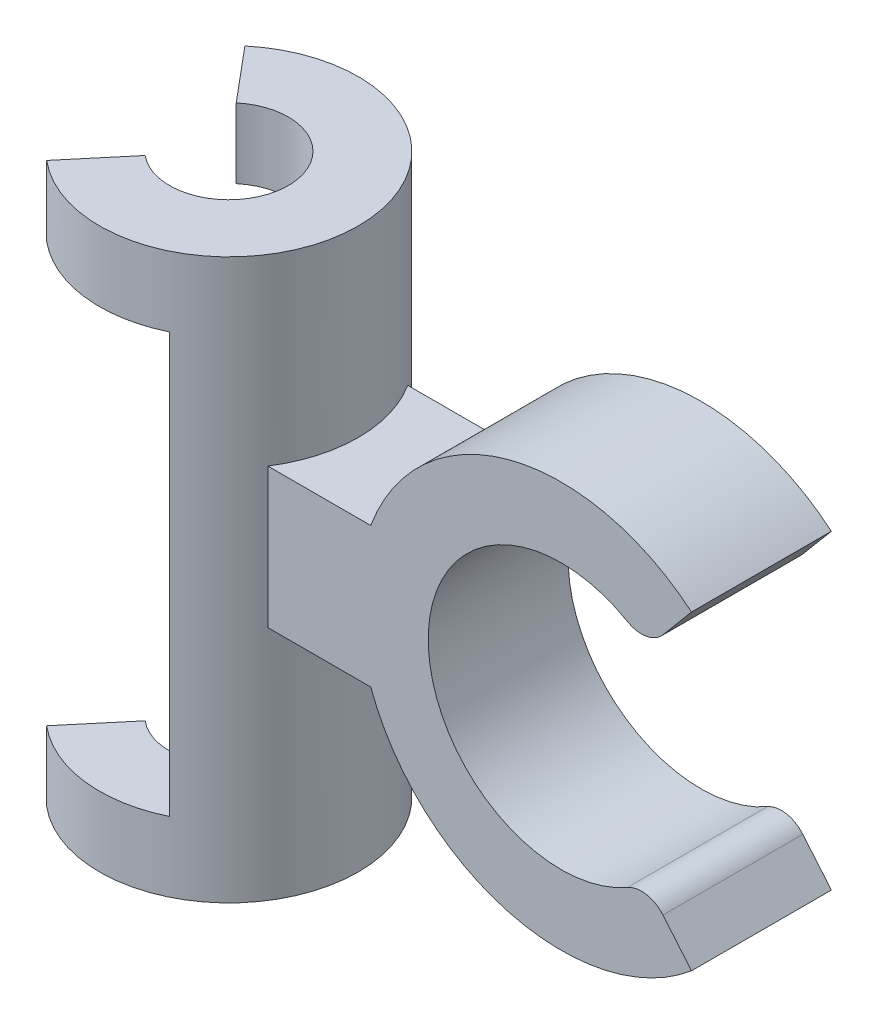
SolidWorks part; units mm, degrees
ref_plane "Front Plane" through (0, 0, 0) normal (0, 0, 1) x (1, 0, 0)
ref_plane "Top Plane" through (0, 0, 0) normal (0, 1, 0) x (1, 0, 0)
ref_plane "Right Plane" through (0, 0, 0) normal (1, 0, 0) x (0, 0, -1)
body saved out of another part "Stock-Test-1"
